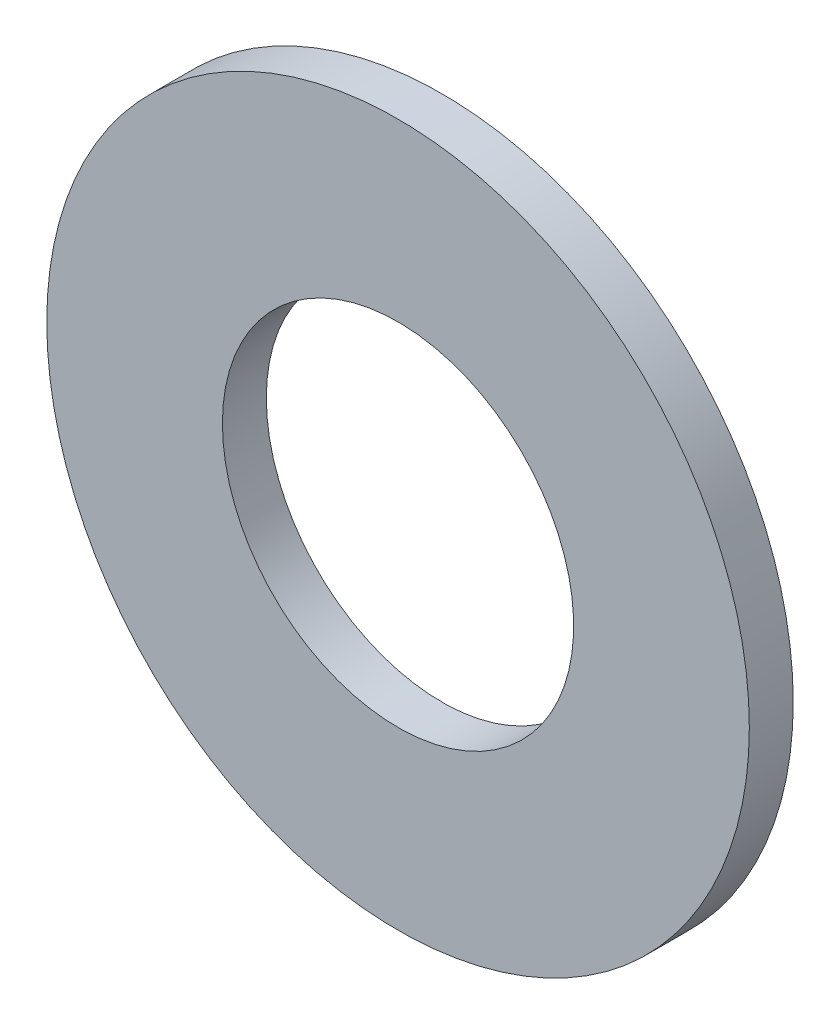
SolidWorks part; units mm, degrees
ref_plane "Plan1" through (0, 0, 0) normal (0, 0, 1) x (1, 0, 0)
ref_plane "Plan2" through (0, 0, 0) normal (0, 1, 0) x (1, 0, 0)
ref_plane "Plan3" through (0, 0, 0) normal (1, 0, 0) x (0, 0, -1)
ref_plane "Plan4" through (0, 0, 1) normal (0, 0, -1) x (-1, 0, 0)
sketch "Esquisse2" plane through (0, 0, 1) normal (0, 0, -1) x (-1, 0, 0)
  circle A0 centre (-11.3689, 14.538) radius 2 construction
  circle A1 centre (-11.3689, 14.538) radius 2
  circle A2 centre (-11.3689, 14.538) radius 4
  dimension "D1" = 2
extrude "Base-Extrusion" add sketch "Esquisse2" against normal blind 0.5
